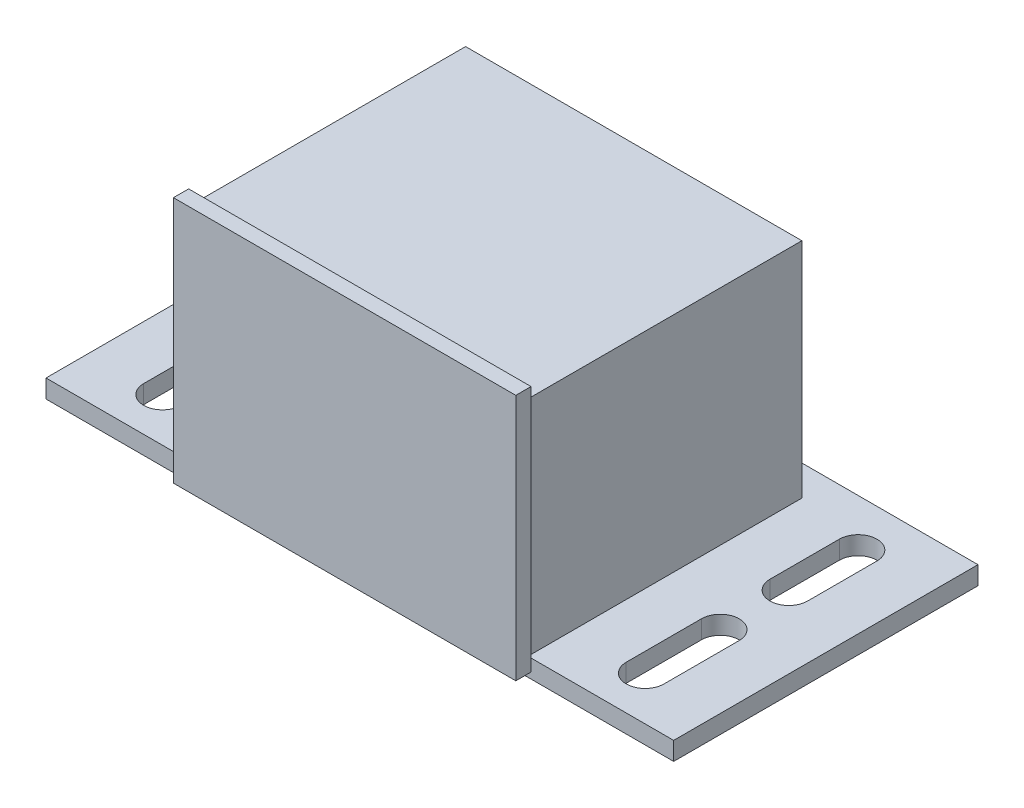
SolidWorks part; units mm, degrees
ref_plane "Front Plane" through (0, 0, 0) normal (0, 0, 1) x (1, 0, 0)
ref_plane "Top Plane" through (0, 0, 0) normal (0, 1, 0) x (1, 0, 0)
ref_plane "Right Plane" through (0, 0, 0) normal (1, 0, 0) x (0, 0, -1)
sketch "Sketch1" plane through (0, 0, 0) normal (0, 1, 0) x (1, 0, 0)
  line L1 (-26.1938, -12.7) -> (26.1937, -12.7)
  line L2 (-26.1938, -12.7) -> (-26.1938, 12.7)
  line L3 (-26.1938, 12.7) -> (26.1937, 12.7)
  line L4 (26.1937, -12.7) -> (26.1937, 12.7)
  line L5 (-26.1938, -12.7) -> (26.1937, 12.7) construction
  line L6 (-26.1938, 12.7) -> (26.1937, -12.7) construction
  point P0 (0, 0)
  dimension "D1" = 25.4
  dimension "D2" = 52.3875
extrude "Boss-Extrude1" add sketch "Sketch1" along normal blind 1.524
sketch "Sketch2" plane through (0, 0, 12.7) normal (0, 0, 1) x (1, 0, 0)
  line L0 (-26.1938, 0) -> (26.1937, 0) construction
  line L1 (-14.0335, 0) -> (14.0335, 0)
  line L2 (-14.0335, 0) -> (-14.0335, 20.1295)
  line L3 (-14.0335, 20.1295) -> (14.0335, 20.1295)
  line L4 (14.0335, 0) -> (14.0335, 20.1295)
  dimension "D1" = 20.1295
  dimension "D2" = 28.067
extrude "Boss-Extrude2" add sketch "Sketch2" against normal blind 22.86
sketch "Sketch3" plane through (0, 0, 12.7) normal (0, 0, 1) x (1, 0, 0)
  line L0 (-26.1938, 0) -> (26.1937, 0) construction
  line L1 (-14.2875, 21.1455) -> (14.2875, 21.1455)
  line L2 (-14.2875, 21.1455) -> (-14.2875, 0.508)
  line L3 (-14.2875, 0.508) -> (14.2875, 0.508)
  line L4 (14.2875, 21.1455) -> (14.2875, 0.508)
  line L5 (0, 0) -> (0, 0.508) construction
  dimension "D1" = 0.508
  dimension "D2" = 28.575
  dimension "D3" = 20.6375
extrude "Boss-Extrude3" add sketch "Sketch3" along normal blind 1.27
sketch "Sketch4" plane through (0, 1.524, 0) normal (0, 1, 0) x (1, 0, 0)
  line L0 (-20.1379, 8.7543) -> (-20.1379, 2.9653) construction
  line L1 (-18.5631, 8.7543) -> (-18.5631, 2.9653)
  line L2 (-21.7127, 8.7543) -> (-21.7127, 2.9653)
  line L3 (-20.1379, -2.7497) -> (-20.1379, -9.0282) construction
  line L4 (-18.5631, -2.7497) -> (-18.5631, -9.0282)
  line L5 (-21.7127, -2.7497) -> (-21.7127, -9.0282)
  line L6 (-20.1379, 2.9653) -> (-20.1379, -2.7497) construction
  line L7 (-20.1379, 0.1078) -> (0, 0) construction
  arc A0 (-18.5631, 8.7543) -> (-21.7127, 8.7543) centre (-20.1379, 8.7543) ccw
  arc A1 (-21.7127, 2.9653) -> (-18.5631, 2.9653) centre (-20.1379, 2.9653) ccw
  arc A2 (-18.5631, -2.7497) -> (-21.7127, -2.7497) centre (-20.1379, -2.7497) ccw
  arc A3 (-21.7127, -9.0282) -> (-18.5631, -9.0282) centre (-20.1379, -9.0282) ccw
  point P2 (-20.1379, 5.8598)
  point P7 (-20.1379, -5.889)
  dimension "D1" = 1.5748
  dimension "D2" = 5.715
extrude "Cut-Extrude1" cut sketch "Sketch4" against normal through all
mirror "Mirror1" about plane through (0, 0, 0) normal (1, 0, 0) of "Cut-Extrude1"
